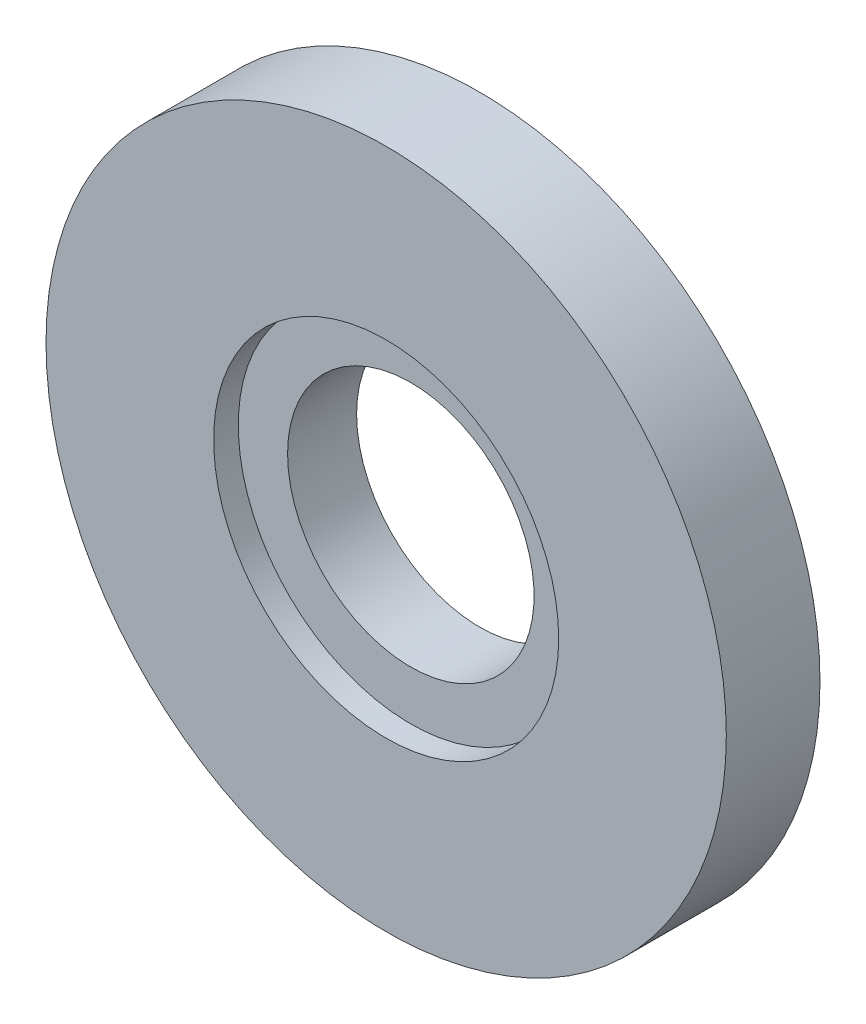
SolidWorks part; units mm, degrees
ref_plane "Front Plane" through (0, 0, 0) normal (0, 0, 1) x (1, 0, 0)
ref_plane "Top Plane" through (0, 0, 0) normal (0, 1, 0) x (1, 0, 0)
ref_plane "Right Plane" through (0, 0, 0) normal (1, 0, 0) x (0, 0, -1)
sketch "Sketch1" plane through (0, 0, 0) normal (0, 0, 1) x (1, 0, 0)
  circle A0 centre (0, 0) radius 3.175
  circle A1 centre (0, 0) radius 8.763
  dimension "D1" = 6.35
  dimension "D2" = 17.526
extrude "washer" add sketch "Sketch1" along normal blind 2.413
sketch "Sketch2" plane through (0, 0, 2.413) normal (0, 0, 1) x (1, 0, 0)
  circle A0 centre (0, 0) radius 4.445
  dimension "D1" = 8.89
extrude "flange_recess" cut sketch "Sketch2" against normal blind 0.635
